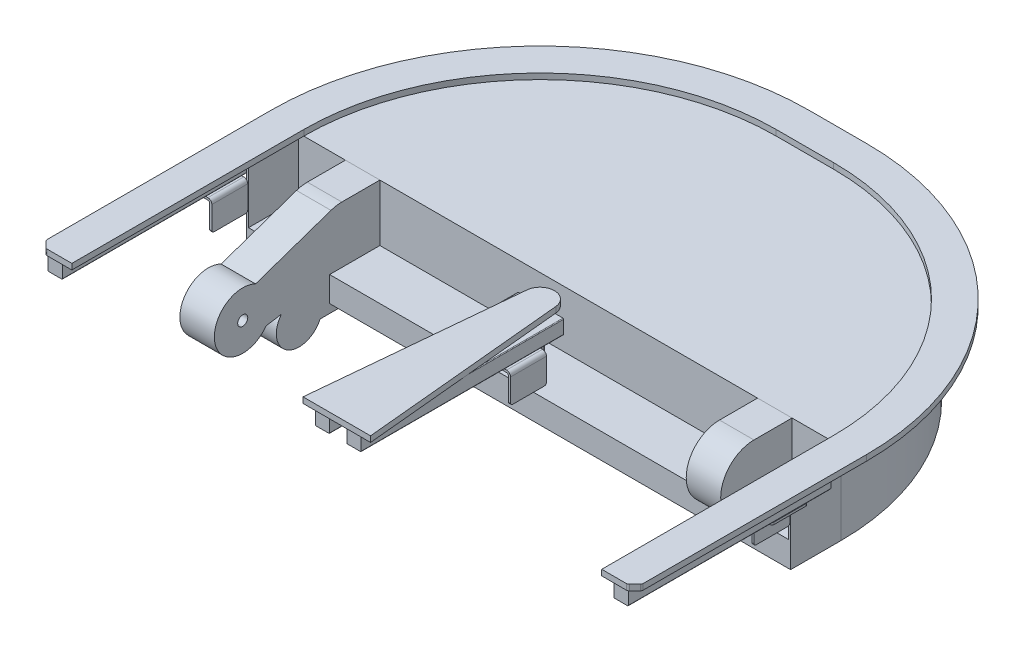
SolidWorks part; units mm, degrees
ref_plane "Front Plane" through (0, 0, 0) normal (0, 0, 1) x (1, 0, 0)
ref_plane "Top Plane" through (0, 0, 0) normal (0, 1, 0) x (1, 0, 0)
ref_plane "Right Plane" through (0, 0, 0) normal (1, 0, 0) x (0, 0, -1)
sketch "Sketch1" plane through (0, 0, 0) normal (0, 1, 0) x (1, 0, 0)
  line L0 (0, 0) -> (-336, 0)
  line L1 (416, 0) -> (80, 0)
  line L2 (-168, 0) -> (-168, -50) construction
  line L3 (248, 0) -> (248, -50) construction
  line L4 (-328, -50) -> (-8, -50) construction
  line L5 (40, 0) -> (40, 336) construction
  line L6 (0, 336) -> (80, 336)
  line L7 (0, 0) -> (80, 0)
  arc A0 (-336, 0) -> (0, 336) centre (0, 0) cw
  arc A1 (80, 336) -> (416, 0) centre (80, 0) cw
  dimension "D4" = 50
  dimension "D1" = 80
  dimension "D2" = 320
  dimension "D5" = 8
  dimension "D6" = 8
extrude "Boss-Extrude1" add sketch "Sketch1" along normal blind 114
ref_plane "Plane1" through (-168, 0, 0) normal (-1, 0, 0) x (0, 0, 1)
ref_plane "Plane2" through (248, 0, 0) normal (-1, 0, 0) x (0, 0, 1)
ref_plane "Plane3" through (0, 0, 2) normal (0, 0, 1) x (1, 0, 0)
ref_plane "Plane4" through (0, 0, 2) normal (0, 0, 1) x (1, 0, 0)
sketch "Sketch2" plane through (0, 0, 0) normal (0, -1, 0) x (1, 0, 0)
  line L1 (80, -336) -> (0, -336) construction
  line L2 (416, 70) -> (416, 0)
  line L3 (416, 70) -> (-336, 70)
  line L4 (-336, 0) -> (-336, 70)
  line L5 (80, -336) -> (0, -336)
  arc A3 (-336, 0) -> (0, -336) centre (0, 0) ccw construction
  arc A4 (80, -336) -> (416, 0) centre (80, 0) ccw construction
  arc A5 (-336, 0) -> (0, -336) centre (0, 0) ccw
  arc A6 (80, -336) -> (416, 0) centre (80, 0) ccw
  dimension "D1" = 70
extrude "Boss-Extrude2" add sketch "Sketch2" against normal blind 35
sketch "Sketch17" plane through (0, 0, 0) normal (0, -1, 0) x (1, 0, 0)
  line L1 (317.5879, -237.5879) -> (272.5879, -237.5879) construction
  line L2 (317.5879, -237.5879) -> (317.5879, -192.5879) construction
  line L3 (317.5879, -192.5879) -> (272.5879, -192.5879) construction
  line L4 (272.5879, -237.5879) -> (272.5879, -192.5879) construction
  line L5 (295.0879, -192.5879) -> (295.0879, -237.5879) construction
  line L6 (317.5879, -215.0879) -> (272.5879, -215.0879) construction
  line L7 (40, 70) -> (40, -336) construction
  line L9 (80, -336) -> (0, -336) construction
  line L10 (416, 70) -> (-336, 70) construction
  arc A0 (80, -336) -> (416, 0) centre (80, 0) ccw construction
  circle A1 centre (295.0879, -215.0879) radius 5.5
  circle A2 centre (-215.0879, -215.0879) radius 5.5
  point P0 (295.0879, -215.0879)
  dimension "D2" = 11
  dimension "D1" = 45
extrude "Cut-Extrude3" cut sketch "Sketch17" against normal blind 30
sketch "Sketch8" plane through (-336, 0, 0) normal (-1, 0, 0) x (0, 0, 1)
  line L0 (0, 114) -> (0, 35)
  line L1 (3.5, -12) -> (83.3659, -12)
  line L2 (173.1463, 75.2797) -> (68.0946, 111.4727)
  line L3 (0, 114) -> (53, 114)
  line L4 (137.0596, 20.7418) -> (158.6327, 17.2894)
  line L5 (70, 35) -> (70, 0) construction
  line L6 (0, 114) -> (0, 35) construction
  line L7 (70, 35) -> (0, 35) construction
  line L8 (0, 35) -> (70, 35)
  line L9 (3.5, 0) -> (3.5, -12)
  line L10 (0, 35) -> (0, 0) construction
  line L11 (70, 0) -> (0, 0) construction
  line L12 (70, 35) -> (70, 0)
  line L13 (70, 0) -> (3.5, 0)
  line L14 (0, 74.5) -> (4, 74.5) construction
  line L15 (4, 74.5) -> (191, 74.5) construction
  arc A0 (83.3659, -12) -> (137.0596, 20.7418) centre (112.5, 0.62) ccw
  arc A1 (158.6327, 17.2894) -> (173.1463, 75.2797) centre (191, 40) ccw
  circle A2 centre (191, 40) radius 7
  arc A3 (68.0946, 111.4727) -> (53, 114) centre (53, 67.66) ccw
  circle A4 centre (191, 40) radius 27.54 construction
  circle A5 centre (112.5, 0.62) radius 23.75 construction
  dimension "D1" = 14
  dimension "D2" = 8
  dimension "D3" = 12
  dimension "D4" = 46.34
  dimension "D5" = 39.54
  dimension "D6" = 31.75
  dimension "D7" = 53
  dimension "D9" = 112.5
  dimension "D10" = 5
  dimension "D11" = 34.38
  dimension "D12" = 3.5
  dimension "D13" = 12
  dimension "D14" = 4
  dimension "D15" = 187
extrude "Boss-Extrude7" add sketch "Sketch8" against normal blind 48 from offset 65 separate body
ref_plane "Plane6" through (40, 0, 0) normal (1, 0, 0) x (0, 0, -1)
sketch "Sketch9" plane through (-336, 0, 0) normal (-1, 0, 0) x (0, 0, 1)
  line L0 (0, 114) -> (53, 114) construction
  line L1 (0, 114) -> (0, 35) construction
  line L2 (0, 35) -> (70, 35) construction
  line L3 (70, 35) -> (70, 0) construction
  line L4 (0, 114) -> (53, 114)
  line L5 (0, 114) -> (0, 35)
  line L6 (0, 35) -> (70, 35)
  line L7 (70, 35) -> (70, 24.5509)
  arc A0 (68.0946, 111.4727) -> (53, 114) centre (53, 67.66) ccw construction
  arc A1 (70, 24.5509) -> (53, 114) centre (53, 67.66) ccw
extrude "Boss-Extrude8" add sketch "Sketch9" against normal blind 48 from offset 65 separate body
sketch "Sketch11" plane through (-336, 0, 0) normal (-1, 0, 0) x (0, 0, 1)
  line L7 (3.5, -12) -> (83.3659, -12) construction
  line L11 (0, 114) -> (53, 114) construction
  line L12 (0, 114) -> (0, 35) construction
  line L13 (0, 35) -> (70, 35) construction
  line L14 (70, 35) -> (70, 0) construction
  line L15 (70, 0) -> (3.5, 0) construction
  line L16 (3.5, 0) -> (3.5, -12) construction
  line L17 (3.5, -12) -> (83.3659, -12)
  line L18 (137.0596, 20.7418) -> (158.6327, 17.2894)
  line L19 (200.6347, 78.3482) -> (64.2916, 112.6032)
  line L20 (0, 114) -> (53, 114)
  line L21 (0, 114) -> (0, 35)
  line L22 (0, 35) -> (70, 35)
  line L23 (70, 35) -> (70, 0)
  line L24 (70, 0) -> (3.5, 0)
  line L25 (3.5, 0) -> (3.5, -12)
  line L26 (4, 74.5) -> (191, 74.5) construction
  arc A3 (83.3659, -12) -> (137.0596, 20.7418) centre (112.5, 0.62) ccw construction
  arc A5 (68.0946, 111.4727) -> (53, 114) centre (53, 67.66) ccw construction
  arc A9 (83.3659, -12) -> (137.0596, 20.7418) centre (112.5, 0.62) ccw
  arc A10 (158.6327, 17.2894) -> (200.6347, 78.3482) centre (191, 40) ccw
  arc A12 (64.2916, 112.6032) -> (53, 114) centre (53, 67.66) ccw
  circle A13 centre (191, 40) radius 27.54 construction
  arc A14 (158.6327, 17.2894) -> (173.1463, 75.2797) centre (191, 40) ccw construction
  circle A15 centre (191, 40) radius 27.54 construction
  circle A16 centre (191, 40) radius 7
  circle A17 centre (191, 40) radius 7 construction
  circle A18 centre (112.5, 0.62) radius 23.75 construction
  dimension "D1" = 187
extrude "Boss-Extrude9" add sketch "Sketch11" against normal up to vertex (113 mm away) from vertex at -65 separate body
mirror "Mirror3" about plane through (40, 0, 0) normal (1, 0, 0)
sketch "Sketch3" plane through (0, 0, 0) normal (0, -1, 0) x (1, 0, 0)
  line L0 (-336, 70) -> (-336, 0) construction
  line L2 (-336, 70) -> (-336, 0)
  line L3 (80, -336) -> (0, -336) construction
  line L4 (416, 0) -> (416, 70) construction
  line L5 (80, -336) -> (0, -336)
  line L6 (416, 0) -> (416, 70)
  line L7 (-339, 70) -> (-339, 0)
  line L8 (80, -339) -> (0, -339)
  line L9 (419, 0) -> (419, 70)
  line L10 (-339, 70) -> (-336, 70)
  line L11 (416, 70) -> (419, 70)
  arc A0 (-336, 0) -> (0, -336) centre (0, 0) ccw construction
  arc A1 (-336, 0) -> (0, -336) centre (0, 0) ccw
  arc A2 (-339, 0) -> (0, -339) centre (0, 0) ccw
  arc A3 (80, -336) -> (416, 0) centre (80, 0) ccw construction
  arc A4 (80, -336) -> (416, 0) centre (80, 0) ccw
  arc A5 (80, -339) -> (419, 0) centre (80, 0) ccw
  point P3 (-339, 70)
  point P5 (70, -336)
  point P6 (-339, 0)
  point P8 (0, -339)
  point P9 (70, -339)
  dimension "D1" = 3
extrude "Boss-Extrude3" add sketch "Sketch3" against normal blind 122
ref_plane "Plane5" through (0, 115.5, 0) normal (0, 1, 0) x (1, 0, 0)
sketch "Sketch4" plane through (0, 122, 0) normal (0, 1, 0) x (1, 0, 0)
  line L0 (-336, 0) -> (-336, -70) construction
  line L1 (80, 336) -> (0, 336) construction
  line L2 (-336, 0) -> (-336, -36) construction
  line L3 (80, 336) -> (0, 336) construction
  line L4 (0, 375) -> (80, 375)
  line L5 (-329, 0) -> (-329, -36)
  line L6 (455, 0) -> (455, -36)
  line L7 (-375, 0) -> (-375, -36)
  line L8 (-329, -36) -> (-375, -36)
  line L9 (455, -36) -> (409, -36)
  line L11 (506.7556, 329) -> (0, 329) construction
  line L12 (506.7556, 336) -> (0, 336) construction
  line L13 (506.7556, 375) -> (0, 375) construction
  line L14 (409, -36) -> (409, 0)
  line L15 (80, 329) -> (0, 329)
  arc A0 (0, 336) -> (-336, 0) centre (0, 0) ccw construction
  arc A1 (0, 336) -> (-336, 0) centre (0, 0) ccw construction
  arc A2 (0, 329) -> (-329, 0) centre (0, 0) ccw
  arc A3 (0, 375) -> (-375, 0) centre (0, 0) ccw
  arc A4 (416, 0) -> (80, 336) centre (80, 0) ccw construction
  arc A5 (416, 0) -> (80, 336) centre (80, 0) ccw construction
  arc A6 (80, 375) -> (455, 0) centre (80, 0) cw
  arc A7 (409, 0) -> (80, 329) centre (80, 0) ccw
  dimension "D3" = 36
  dimension "D1" = 7
  dimension "D2" = 46
extrude "Boss-Extrude4" add sketch "Sketch4" against normal blind 8
sketch "Sketch15" plane through (0, 35, 0) normal (0, 1, 0) x (1, 0, 0)
  line L0 (40, -70) -> (40, -52) construction
  line L1 (416, -70) -> (-336, -70) construction
  circle A0 centre (40, -52) radius 12.7
  dimension "D2" = 25.4
  dimension "D1" = 18
extrude "Boss-Extrude13" add sketch "Sketch15" along normal up to surface (79 mm away)
sketch "Sketch6" plane through (0, 114, 0) normal (0, 1, 0) x (1, 0, 0)
  line L0 (40, 0) -> (40, 336) construction
  line L1 (-7, -323) -> (40, -323)
  line L2 (-7, 7) -> (40, 7)
  line L3 (40, 7) -> (40, -323)
  line L5 (0, 0) -> (-7, 7) construction
  line L6 (-329, 0) -> (409, 0) construction
  line L7 (-7, -323) -> (-7, 7)
  line L9 (0, 0) -> (0, -3) construction
extrude "Boss-Extrude6" add sketch "Sketch6" along normal blind 8
mirror "Mirror1" about plane through (40, 0, 0) normal (1, 0, 0) of "Boss-Extrude6"
sketch "Sketch7" plane through (0, 122, 0) normal (0, 1, 0) x (1, 0, 0)
  line L0 (-314.3223, 88.0482) -> (-95.1192, -131.1549) construction
  line L1 (-88.0482, -131.1549) -> (131.1549, 88.0482) construction
  line L2 (131.1549, 95.1192) -> (-88.0482, 314.3223) construction
  line L3 (-95.1192, 314.3223) -> (-314.3223, 95.1192) construction
  line L4 (-204.7208, -21.5534) -> (21.5534, 204.7208) construction
  line L5 (-204.7208, 204.7208) -> (21.5534, -21.5534) construction
  line L8 (40, 7) -> (40, -323) construction
  line L9 (-329, 0) -> (-7, 0) construction
  line L10 (-328, -50) -> (-8, -50) construction
  line L11 (-7, 7) -> (-7, -323) construction
  line L12 (87, 7) -> (87, -323) construction
  line L13 (87, 7) -> (-7, 7) construction
  line L14 (-336, -70) -> (-336, 0) construction
  line L16 (-324, -320) -> (-324, 0) construction
  line L17 (-7, -323) -> (87, -323) construction
  line L18 (40, -19.8061) -> (58.4466, -21.5534)
  line L19 (58.4466, -21.5534) -> (87, -323)
  line L20 (-7, -323) -> (21.5534, -21.5534)
  line L21 (21.5534, -21.5534) -> (40, -19.8061)
  line L22 (-329, -36) -> (-329, 0) construction
  line L23 (-7, 7) -> (-7, -323)
  line L24 (-7, 7) -> (40, 47)
  line L25 (87, 7) -> (87, -323)
  line L26 (0, 324) -> (500, 324) construction
  line L27 (40, 47) -> (87, 7)
  arc A0 (-314.3223, 88.0482) -> (-314.3223, 95.1192) centre (-310.7868, 91.5837) cw construction
  arc A1 (-95.1192, -131.1549) -> (-88.0482, -131.1549) centre (-91.5837, -127.6194) ccw construction
  arc A2 (131.1549, 88.0482) -> (131.1549, 95.1192) centre (127.6194, 91.5837) ccw construction
  arc A3 (-88.0482, 314.3223) -> (-95.1192, 314.3223) centre (-91.5837, 310.7868) ccw construction
  arc A6 (-324, 0) -> (0, 324) centre (0, 0) cw construction
  arc A7 (0, 329) -> (-329, 0) centre (0, 0) ccw construction
extrude "Cut-Extrude1" cut sketch "Sketch7" against normal up to surface (8 mm away)
sketch "Sketch12" plane through (0, 122, 0) normal (0, 1, 0) x (1, 0, 0)
  line L0 (-375, -36) -> (-329, -36)
  line L1 (-375, -36) -> (-375, -323)
  line L2 (-329, -36) -> (-329, -323)
  line L3 (-375, -323) -> (-329, -323)
  line L4 (-375, 0) -> (-375, -36) construction
  line L5 (455, -36) -> (455, -323)
  line L6 (455, -323) -> (409, -323)
  line L7 (409, -323) -> (409, -36)
  line L8 (409, -36) -> (455, -36)
  line L9 (-7, -323) -> (87, -323) construction
extrude "Boss-Extrude10" add sketch "Sketch12" against normal up to surface (8 mm away)
chamfer "Chamfer2" distance 10 angle 45 2 edges at (455, 118, 323) (-375, 118, 323)
fillet "Fillet5" radius 4 4 edges at (-365, 118, 323) (-375, 118, 313) (445, 118, 323) (455, 118, 313)
fillet "Fillet3" radius 20 3 edges at (21.5534, 118, 21.5534) (58.4466, 118, 21.5534) (40, 118, 19.8061)
delete or keep bodies "Body-Delete/Keep 3" type delete bodies bodies 117 114
delete or keep bodies "Body-Delete/Keep 4" type delete bodies bodies 115
delete or keep bodies "Body-Delete/Keep 5" [suppressed] type delete bodies bodies 116
delete or keep bodies "Body-Delete/Keep 6" [suppressed] type delete bodies bodies 112
delete or keep bodies "Body-Delete/Keep 7" type delete bodies bodies 118
sketch "Sketch13" plane through (0, 114, 0) normal (0, -1, 0) x (1, 0, 0)
  line L0 (-329, 323) -> (-363.3431, 323) construction
  line L1 (-364, 39) -> (-344, 39)
  line L2 (-364, 39) -> (-364, 321)
  line L3 (-364, 321) -> (-344, 321)
  line L4 (-344, 39) -> (-344, 321)
  line L5 (-329, 323) -> (-329, 0) construction
  line L6 (-329, 0) -> (409, 0) construction
  dimension "D1" = 2
  dimension "D2" = 20
  dimension "D3" = 15
  dimension "D4" = 39
extrude "Boss-Extrude11" add sketch "Sketch13" along normal blind 20 separate body
sketch "Sketch14" plane through (0, 0, 39) normal (0, 0, -1) x (-1, 0, 0)
  line L0 (364, 94) -> (341.54, 94)
  line L1 (336, 88.46) -> (336, 54)
  line L2 (336, 54) -> (339, 54)
  line L3 (339, 54) -> (339, 88.46)
  line L4 (341.54, 91) -> (364, 91)
  line L5 (364, 91) -> (364, 94)
  line L6 (364, 94) -> (344, 94) construction
  line L7 (364, 94) -> (364, 114) construction
  line L8 (344, 94) -> (344, 114) construction
  arc A0 (341.54, 94) -> (336, 88.46) centre (341.54, 88.46) ccw
  arc A1 (339, 88.46) -> (341.54, 91) centre (341.54, 88.46) cw
  dimension "D4" = 2.54
  dimension "D1" = 3
  dimension "D2" = 40
  dimension "D3" = 8
extrude "Boss-Extrude12" add sketch "Sketch14" against normal blind 50 from offset 32 separate body
fillet "Fillet6" radius 3 4 edges at (-337.5, 54, 71) (-337.5, 54, 121) (-364, 92.5, 71) (-364, 92.5, 121)
fillet "Fillet7" radius 1 4 edges at (-364, 114, 180) (-344, 114, 180) (-344, 94, 180) (-364, 94, 180)
mirror "Mirror4" about plane through (40, 0, 0) normal (1, 0, 0)
mirror "Mirror5" about plane through (-168, 0, 0) normal (-1, 0, 0)
mirror "Mirror6" about plane through (248, 0, 0) normal (-1, 0, 0)
equation "\"D4@Sketch7\"=\"D5@Sketch6\""
equation "\"D3@Sketch7\"=\"D5@Sketch6\""
